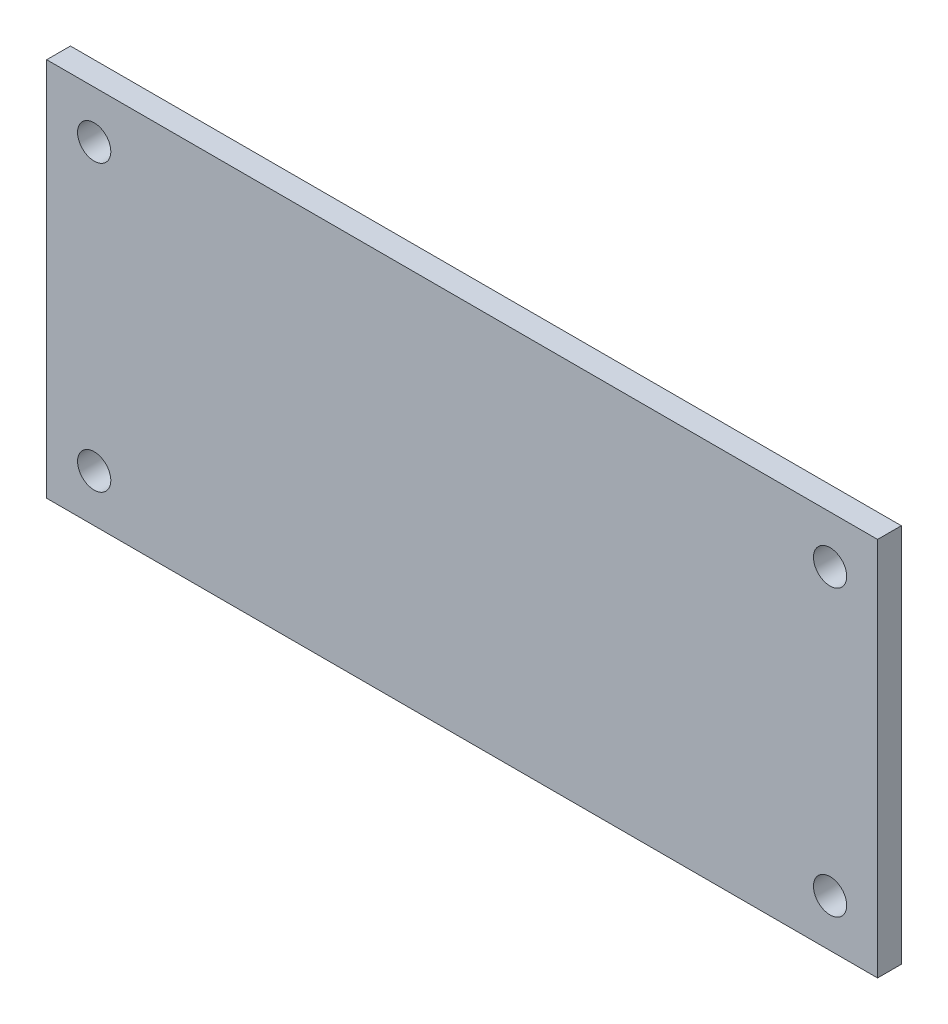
SolidWorks part; units mm, degrees
ref_plane "Face" through (0, 0, 0) normal (0, 0, 1) x (1, 0, 0)
ref_plane "Dessus" through (0, 0, 0) normal (0, 1, 0) x (1, 0, 0)
ref_plane "Droite" through (0, 0, 0) normal (1, 0, 0) x (0, 0, -1)
sketch "Esquisse1" plane through (0, 0, 0) normal (0, 0, 1) x (1, 0, 0)
  line L1 (-175, 45) -> (175, 45)
  line L2 (-175, 45) -> (-175, -115)
  line L3 (-175, -115) -> (175, -115)
  line L4 (175, 45) -> (175, -115)
  circle A0 centre (-155, 25) radius 7
  circle A1 centre (-155, -95) radius 7
  circle A2 centre (155, -95) radius 7
  circle A3 centre (155, 25) radius 7
  dimension "D5" = 14
  dimension "D6" = 14
  dimension "D7" = 14
  dimension "D8" = 14
  dimension "D1" = 350
  dimension "D2" = 175
  dimension "D3" = 160
  dimension "D4" = 115
  dimension "D9" = 20
  dimension "D10" = 20
  dimension "D11" = 20
  dimension "D12" = 20
extrude "Extrusion1" add sketch "Esquisse1" along normal blind 10
